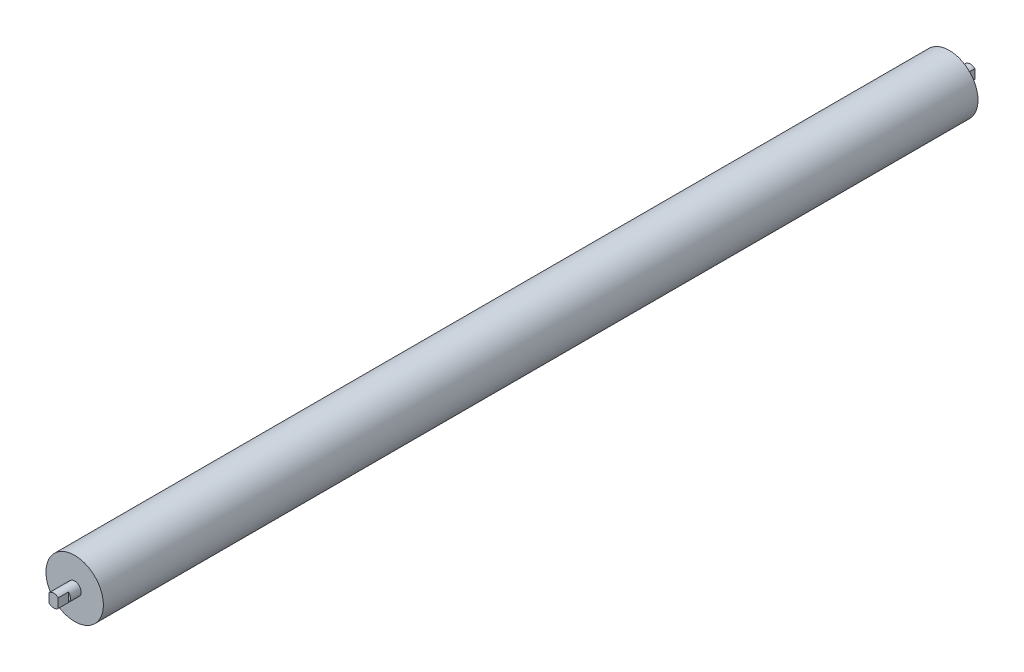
SolidWorks part; units mm, degrees
ref_plane "Front" through (0, 0, 0) normal (0, 0, 1) x (1, 0, 0)
ref_plane "Top" through (0, 0, 0) normal (0, 1, 0) x (1, 0, 0)
ref_plane "Right" through (0, 0, 0) normal (1, 0, 0) x (0, 0, -1)
sketch "Esquisse1" plane through (0, 0, 0) normal (0, 0, 1) x (1, 0, 0)
  circle A2 centre (0, 0) radius 10
  dimension "D4" = 20
extrude "Base-Extrusion" add sketch "Esquisse1" along normal blind 32.5
sketch "Esquisse2" plane through (0, 0, 32.5) normal (0, 0, 1) x (1, 0, 0)
  circle A0 centre (0, 0) radius 44.5
  dimension "D1" = 89
extrude "Boss.-Extru.1" add sketch "Esquisse2" along normal blind 1355
sketch "Esquisse3" plane through (0, 0, 1387.5) normal (0, 0, 1) x (1, 0, 0)
  circle A2 centre (0, 0) radius 10
  dimension "D1" = 20
extrude "Boss.-Extru.2" add sketch "Esquisse3" along normal blind 32.5
sketch "Esquisse4" plane through (0, 0, 1420) normal (0, 0, 1) x (1, 0, 0)
  line L2 (-7, 7.1414) -> (-7, -7.1414)
  line L4 (7, 7.1414) -> (7, -7.1414)
  arc A0 (7, 7.1414) -> (-7, 7.1414) centre (0, 0) ccw
  arc A1 (-7, -7.1414) -> (7, -7.1414) centre (0, 0) ccw
  dimension "D1" = 20
  dimension "D2" = 7
extrude "Enlèv. mat.-Extru.1" cut sketch "Esquisse4" against normal blind 16 flip side to cut
sketch "Esquisse5" plane through (0, 0, 0) normal (0, 0, -1) x (-1, 0, 0)
  line L2 (-7, 7.1414) -> (-7, -7.1414)
  line L4 (7, 7.1414) -> (7, -7.1414)
  arc A0 (7, 7.1414) -> (-7, 7.1414) centre (0, 0) ccw
  arc A1 (-7, -7.1414) -> (7, -7.1414) centre (0, 0) ccw
  dimension "D1" = 20
  dimension "D3" = 7
extrude "Enlèv. mat.-Extru.2" cut sketch "Esquisse5" against normal blind 16 flip side to cut
